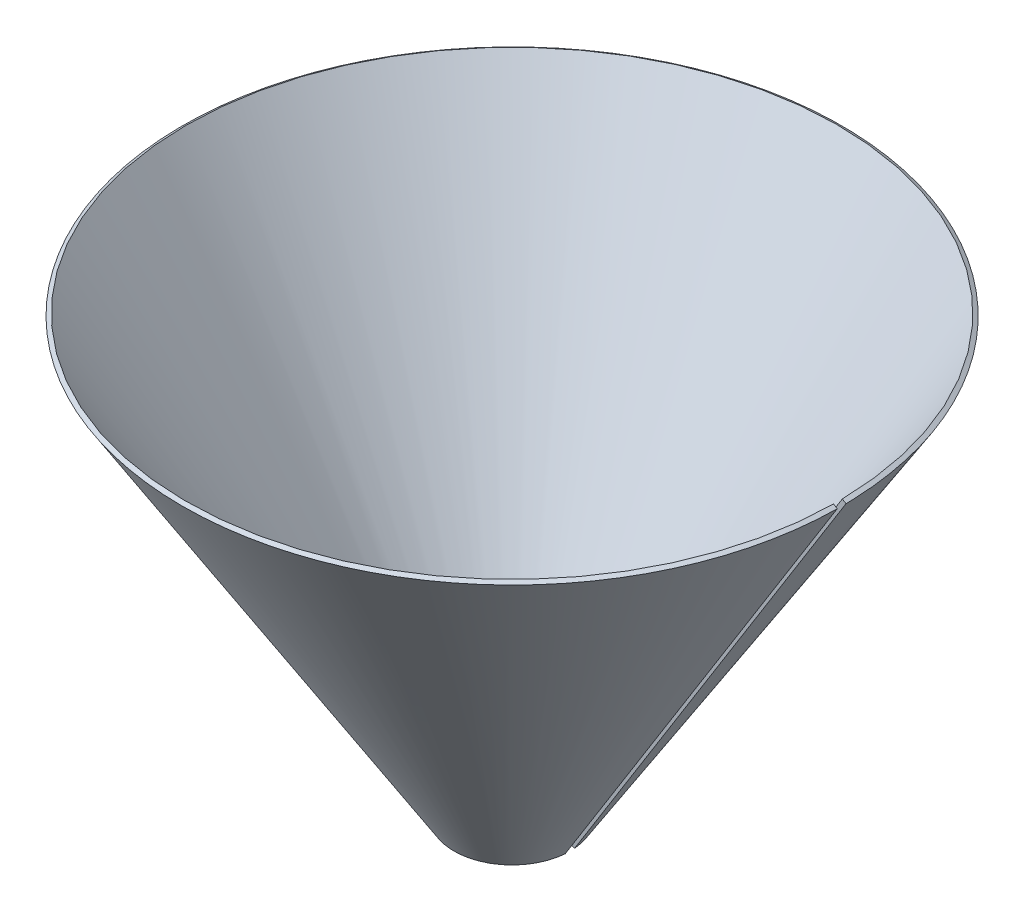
SolidWorks part; units mm, degrees
ref_plane "Ebene vorne" through (0, 0, 0) normal (0, 0, 1) x (1, 0, 0)
ref_plane "Ebene oben" through (0, 0, 0) normal (0, 1, 0) x (1, 0, 0)
ref_plane "Ebene rechts" through (0, 0, 0) normal (1, 0, 0) x (0, 0, -1)
ref_plane "Ebene1" through (0, -100, 0) normal (0, 1, 0) x (-1, 0, 0)
sketch "Skizze1" plane through (0, 0, 0) normal (0, 1, 0) x (1, 0, 0)
  line L0 (0, 0) -> (85.9667, 0) construction
  line L1 (0, -1) -> (85.9667, -1) construction
  line L2 (0, 1) -> (85.9667, 1) construction
  arc A0 (74.9933, 1) -> (74.9933, -1) centre (0, 0) ccw
  dimension "D1" = 150
  dimension "D2" = 1
  dimension "D3" = 1
sketch "Skizze2" plane through (0, -100, 0) normal (0, 1, 0) x (-1, 0, 0)
  line L0 (0, 0) -> (-18.0571, 0) construction
  line L1 (0, 1) -> (-18.0571, 1) construction
  line L2 (0, -1) -> (-18.0571, -1) construction
  arc A0 (-12.4599, -1) -> (-12.4599, 1) centre (0, 0) ccw
  dimension "D1" = 25
  dimension "D2" = 1
  dimension "D3" = 1
sheet metal parameters "Blech1" thickness 1 parameters "D1"=4, "Dicke"=1
lofted bend "Ausgeformte Biegungen1" parameters "D1"=0, "D12"=1
other "Freiform-Biegung1" parameters "D1"=1000, "D4"=57.296, "D5"=1
flat pattern "Abwicklung1"
sketch "Biegung-Linien1" plane through (53.908, -33.7105, 1.2234) normal (-0.8477, 0.5301, -0.0192) x (-0.0163, 0.0102, 0.9998)
  line L0 (-0.2234, 39.7617) -> (-0.2234, -78.1808) construction
  line L1 (28.9689, 36.5171) -> (4.5998, -78.8755) construction
  line L2 (56.9661, 27.3246) -> (9.2812, -80.5394) construction
  line L3 (82.4728, 12.5681) -> (13.531, -83.1128) construction
  line L4 (104.3974, -7.121) -> (17.175, -86.4903) construction
  line L5 (121.8016, -30.9) -> (20.0632, -90.533) construction
  line L6 (133.9406, -57.7513) -> (22.0772, -95.0751) construction
  line L7 (140.2949, -86.5257) -> (23.1342, -99.93) construction
  line L8 (140.5925, -115.9919) -> (23.1908, -104.8984) construction
  line L9 (134.8207, -144.8889) -> (22.2446, -109.7764) construction
  line L10 (123.2266, -171.9799) -> (20.3343, -114.3634) construction
  line L11 (106.3062, -196.1055) -> (17.5379, -118.4707) construction
  line L12 (84.7838, -216.2334) -> (13.9718, -121.9309) construction
  line L13 (59.5803, -231.5021) -> (9.7807, -124.6007) construction
  line L14 (31.7745, -241.2581) -> (5.1376, -126.3706) construction
  line L15 (2.5562, -245.0839) -> (0.2328, -127.1683) construction
  line L16 (-26.7266, -242.8233) -> (-4.6346, -126.9684) construction
other "Abwickeln-<Freiform-Biegung1>1"
